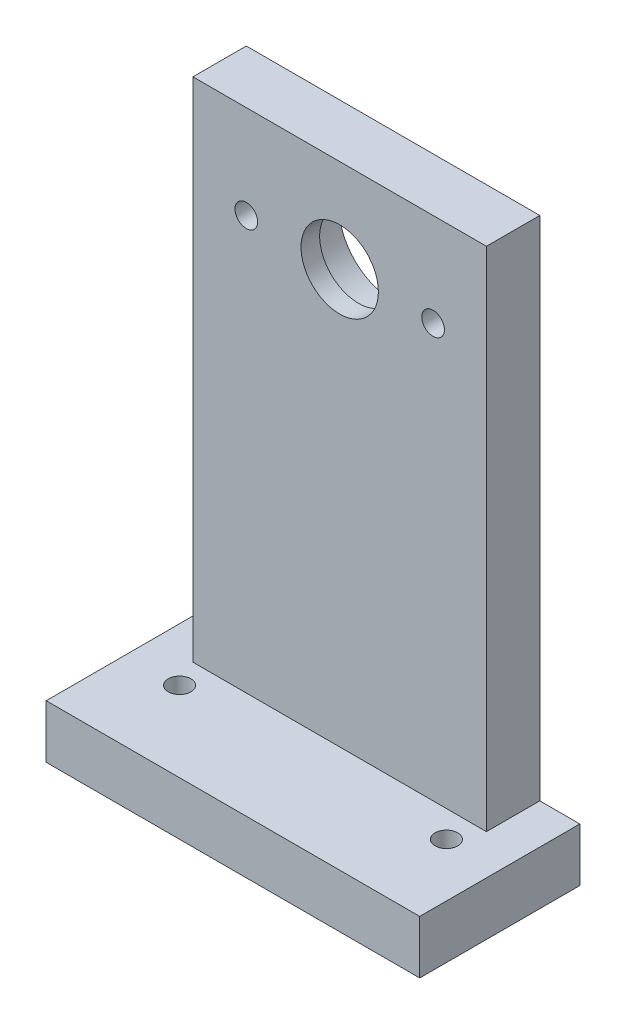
SolidWorks part; units mm, degrees
ref_plane "前视基准面" through (0, 0, 0) normal (0, 0, 1) x (1, 0, 0)
ref_plane "上视基准面" through (0, 0, 0) normal (0, 1, 0) x (1, 0, 0)
ref_plane "右视基准面" through (0, 0, 0) normal (1, 0, 0) x (0, 0, -1)
other "Configuration Table"
sketch "草图1" plane through (0, 0, 0) normal (0, 0, 1) x (1, 0, 0)
  line L1 (-28, 0) -> (28, 0)
  line L2 (-28, 0) -> (-28, 8)
  line L3 (-28, 8) -> (28, 8)
  line L4 (28, 0) -> (28, 8)
extrude "Foot_56x24x8" add sketch "草图1" along normal blind 24
sketch "草图2" plane through (0, 0, 0) normal (0, 0, 1) x (1, 0, 0)
  line L1 (-22, 0) -> (22, 0)
  line L2 (-22, 0) -> (-22, 84)
  line L3 (-22, 84) -> (22, 84)
  line L4 (22, 0) -> (22, 84)
extrude "Tower_pivot_height70" add sketch "草图2" along normal blind 8
sketch "草图3" plane through (0, 0, 0) normal (0, 0, 1) x (1, 0, 0)
  circle A0 centre (0, 70) radius 5.8
  circle A1 centre (-14, 70) radius 1.7
  circle A2 centre (14, 70) radius 1.7
extrude "Shaft_access_and_retainer_M3" cut sketch "草图3" against normal through all and the other way through all
sketch "草图4" plane through (0, 0, 0) normal (0, 0, 1) x (1, 0, 0)
  circle A0 centre (0, 70) radius 8.1
extrude "625ZZ_pocket_D16p2_depth5p2_TEST_FIT" cut sketch "草图4" along normal blind 5.2
sketch "草图5" plane through (0, 0, 0) normal (0, 1, 0) x (1, 0, 0)
  circle A0 centre (-20, -12) radius 1.7
  circle A1 centre (20, -12) radius 1.7
extrude "Foot_M3_through" cut sketch "草图5" against normal through all and the other way through all
